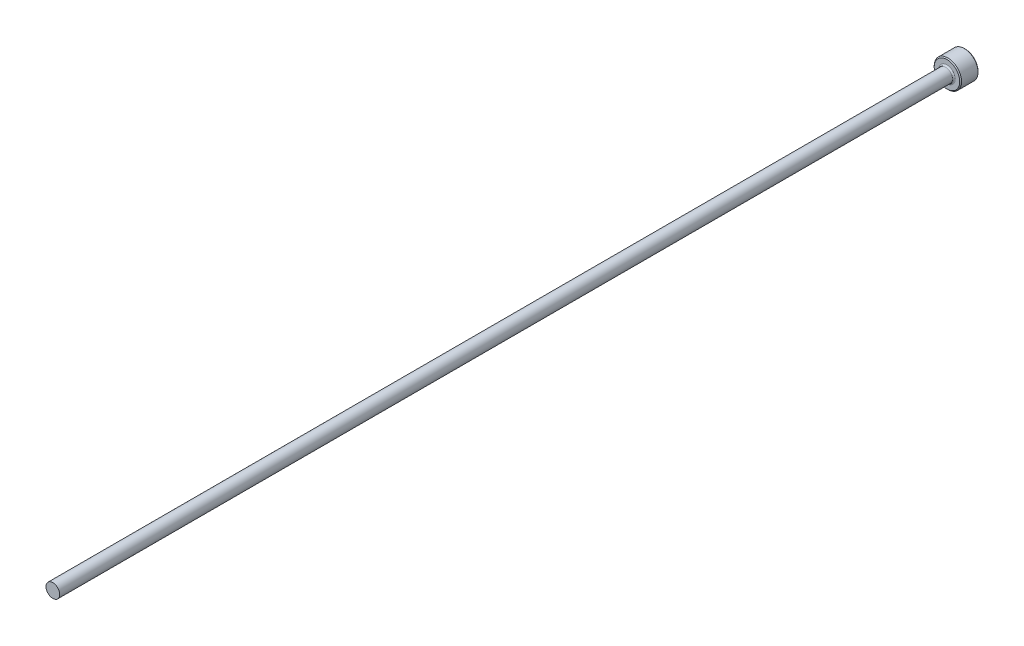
SolidWorks part; units mm, degrees
ref_plane "Front Plane" through (0, 0, 0) normal (0, 0, 1) x (1, 0, 0)
ref_plane "Top Plane" through (0, 0, 0) normal (0, 1, 0) x (1, 0, 0)
ref_plane "Right Plane" through (0, 0, 0) normal (1, 0, 0) x (0, 0, -1)
sketch "Sketch1" plane through (0, 0, 0) normal (1, 0, 0) x (0, 0, -1)
  line L0 (0, 0) -> (0, 3)
  line L1 (0, 3.3) -> (0, -3.3) construction
  line L2 (0, 3) -> (-4, 3)
  line L3 (-4, 3) -> (-4, 1.8)
  line L4 (-4.3, 1.5) -> (-200, 1.5)
  line L5 (-200, 1.5) -> (-200, 0)
  line L6 (3.3, 0) -> (-3.3, 0) construction
  line L7 (-200, 0) -> (0, 0)
  line L8 (-109.0506, 0) -> (16.9928, 0) construction
  arc A0 (-4, 1.8) -> (-4.3, 1.5) centre (-4.3, 1.8) cw
  dimension "D1" = 0.3
  dimension "D2" = 6
  dimension "D3" = 3
  dimension "D4" = 200
  dimension "D5" = 4
revolve "Revolve1" add sketch "Sketch1" angle 360 about L8
chamfer "Chamfer1" distance 0.2 angle 45 2 edges at (3, 0, 0) (3, 0, 4)
